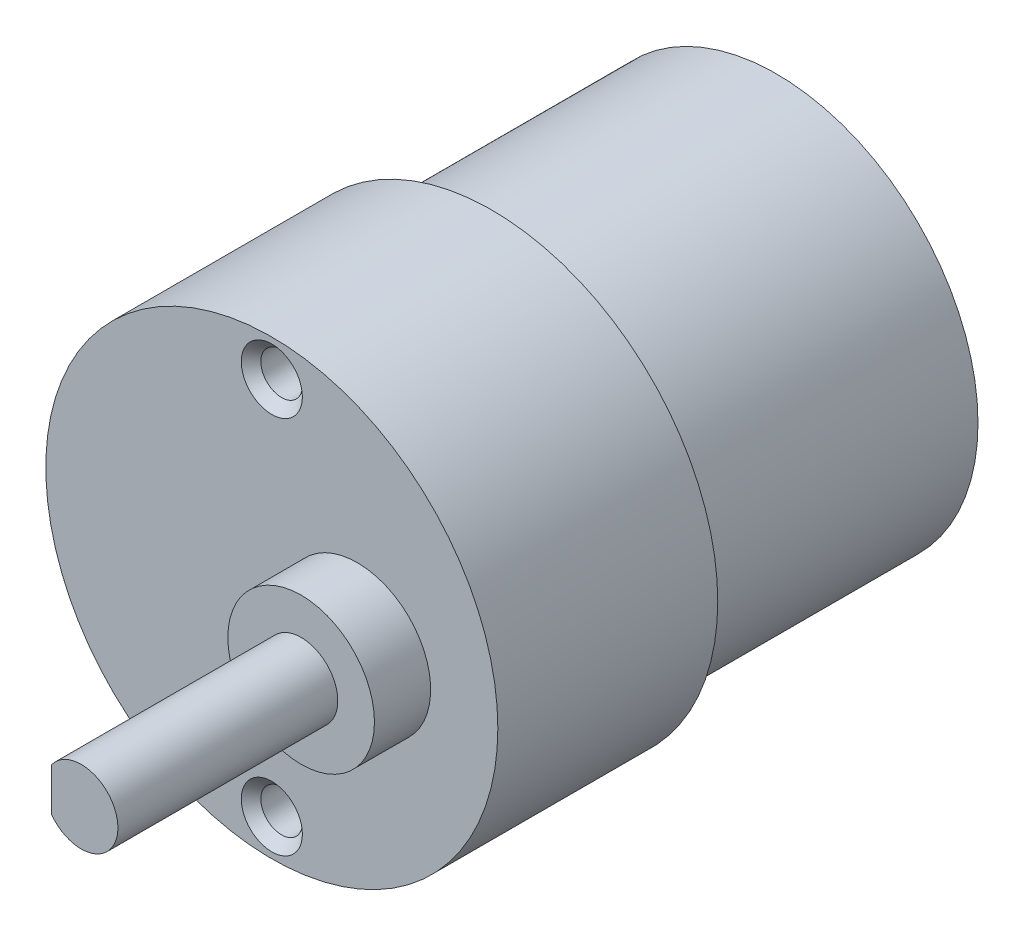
SolidWorks part; units mm, degrees
ref_plane "Front Plane" through (0, 0, 0) normal (0, 0, 1) x (1, 0, 0)
ref_plane "Top Plane" through (0, 0, 0) normal (0, 1, 0) x (1, 0, 0)
ref_plane "Right Plane" through (0, 0, 0) normal (1, 0, 0) x (0, 0, -1)
sketch "Sketch1" plane through (0, 0, 0) normal (0, 1, 0) x (1, 0, 0)
  line L0 (0, 0) -> (0, 18)
  line L1 (0, 18) -> (2, 18)
  line L2 (18.5, 0) -> (18.5, 41.3)
  line L3 (2, 41.3) -> (18.5, 41.3)
  line L4 (2, 41.3) -> (2, 18)
  line L8 (18.5, 0) -> (0, 0)
  dimension "D1" = 18.5
  dimension "D2" = 16.5
  dimension "D3" = 23.3
  dimension "D4" = 18
revolve "Revolve1" add sketch "Sketch1" angle 360 about L2
sketch "Sketch4" plane through (0, 0, 0) normal (0, 0, 1) x (1, 0, 0)
  circle A0 centre (25.5, 0) radius 6
  circle A1 centre (18.5, 0) radius 18.5 construction
  dimension "D1" = 7
extrude "Extrude3" add sketch "Sketch4" along normal blind 4.6
sketch "Sketch5" plane through (0, 0, 4.6) normal (0, 0, 1) x (1, 0, 0)
  line L0 (23.0644, -1.7515) -> (23.0644, 1.7515)
  arc A1 (23.0644, -1.7515) -> (23.0644, 1.7515) centre (25.5, 0) ccw
  dimension "D1" = 2.4356
extrude "Extrude4" add sketch "Sketch5" along normal blind 18
hole_wizard "CSK for M3 Flat Head Machine Screw1" positions "3DSketch2" profile "Sketch6" countersink size "M3" standard "Ansi Metric"
sketch3d "3DSketch2"
  line L1 (25.5, 0, 0) -> (18.5, 0, 0)
  line L2 (25.5, 0, 4.6) -> (25.5, 0, 0) construction
  line L3 (18.5, 0, -18) -> (18.5, 0, 0) construction
  line L4 (18.5, 0, 0) -> (18.5, -15.5, 0)
  circle A0 centre (18.5, 0, 0) radius 18.5 construction
  point P0 (18.5, -15.5, 0)
  point P5 (18.5, 0, 18.5)
  dimension "D1" = 15.5
sketch "Sketch6" plane through (18.5, -15.5, 0) normal (1, 0, 0) x (0, -1, 0)
  line L0 (0, 0) -> (0, 11.0215)
  line L1 (0, 11.0215) -> (1.7, 10)
  line L2 (1.7, 10) -> (1.7, 0.8)
  line L3 (1.7, 0.8) -> (2.5, 0)
  line L5 (2.5, 0) -> (0, 0)
  line L6 (-1.7, 0.8) -> (-2.5, 0) construction
  line L10 (0, 11.0215) -> (-1.7, 10) construction
  line L11 (0, -6.35) -> (0, 107.95) construction
  dimension "Hole Dia." = 3.4
  dimension "Hole Depth" = 10
  dimension "Near C'Sink Dia." = 5
  dimension "Near C'Sink Angle" = 90
  dimension "Drill Angle" = 118
hole_wizard "CSK for M3 Flat Head Machine Screw2" positions "3DSketch3" profile "Sketch8" countersink size "M3" standard "Ansi Metric"
sketch3d "3DSketch3"
  line L7 (19.5183, 0.4677, 0) -> (25.5, 0, 0)
  line L8 (25.5, 0, 4.6) -> (25.5, 0, 0) construction
  line L9 (25.5, 0, 0) -> (25.5, 20.0984, 0)
  circle A0 centre (18.5, 0, 0) radius 18.5 construction
  circle A3 centre (25.5, 0, 0) radius 6 construction
  point P0 (18.5, 15.5, 0)
  point P5 (18.5, 0, 18.5)
  point P27 (25.5, 0, 6)
  dimension "D2" = 7
  dimension "D1" = 15.5
sketch "Sketch8" plane through (18.5, 15.5, 0) normal (1, 0, 0) x (0, -1, 0)
  line L0 (0, 0) -> (0, 11.0215)
  line L1 (0, 11.0215) -> (1.7, 10)
  line L2 (1.7, 10) -> (1.7, 0.8)
  line L3 (1.7, 0.8) -> (2.5, 0)
  line L5 (2.5, 0) -> (0, 0)
  line L6 (-1.7, 0.8) -> (-2.5, 0) construction
  line L10 (0, 11.0215) -> (-1.7, 10) construction
  line L11 (0, -6.35) -> (0, 107.95) construction
  dimension "Hole Dia." = 3.4
  dimension "Hole Depth" = 10
  dimension "Near C'Sink Dia." = 5
  dimension "Near C'Sink Angle" = 90
  dimension "Drill Angle" = 118
